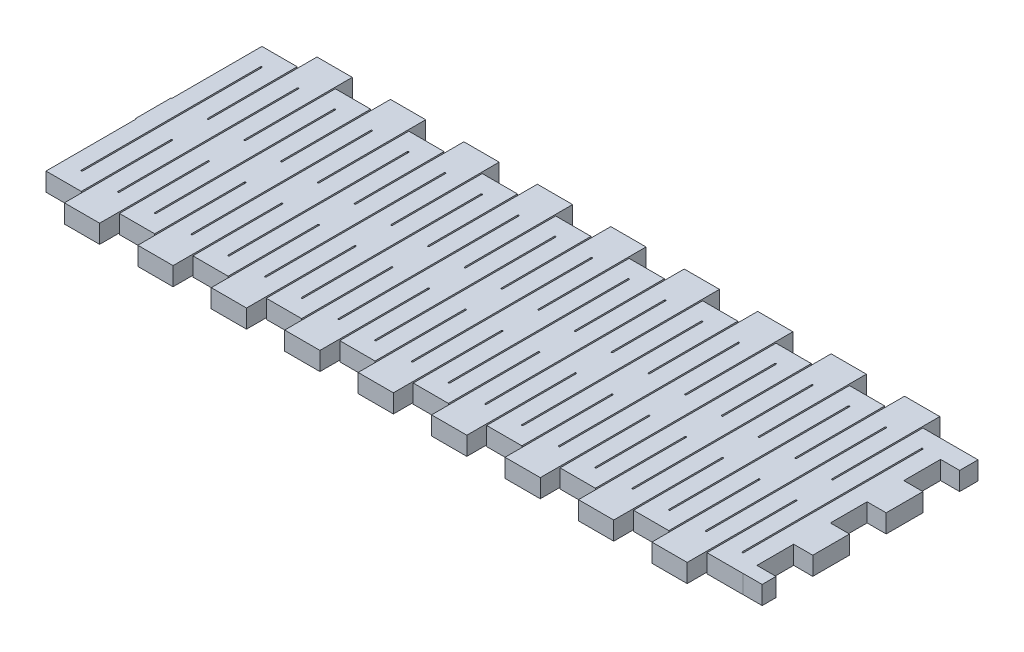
SolidWorks part; units mm, degrees
ref_plane "Front Plane" through (0, 0, 0) normal (0, 0, 1) x (1, 0, 0)
ref_plane "Top Plane" through (0, 0, 0) normal (0, 1, 0) x (1, 0, 0)
ref_plane "Right Plane" through (0, 0, 0) normal (1, 0, 0) x (0, 0, -1)
sketch "Sketch1" plane through (0, 0, 0) normal (0, 1, 0) x (1, 0, 0)
  line L1 (0, 0) -> (123.952, 0)
  line L2 (0, 0) -> (0, 43.688)
  line L3 (0, 43.688) -> (123.952, 43.688)
  line L4 (123.952, 0) -> (123.952, 43.688)
  dimension "D1" = 43.688
  dimension "D2" = 123.952
extrude "body" add sketch "Sketch1" along normal blind 3.175
sketch "Sketch2" plane through (0, 3.175, 0) normal (0, 1, 0) x (1, 0, 0)
  line L0 (0, 43.688) -> (0, 25.019) construction
  line L2 (0.127, 43.688) -> (0.127, 25.019)
  line L3 (-0.127, 43.688) -> (-0.127, 25.019)
  line L4 (0, 21.844) -> (123.952, 21.844) construction
  line L5 (0, 43.688) -> (0, 0) construction
  line L6 (123.952, 0) -> (123.952, 43.688) construction
  line L7 (0, 0) -> (0, 18.669) construction
  line L8 (0.127, 0) -> (0.127, 18.669)
  line L9 (-0.127, 0) -> (-0.127, 18.669)
  line L10 (3.175, 37.338) -> (3.175, 6.35) construction
  line L11 (3.302, 37.338) -> (3.302, 6.35)
  line L12 (3.048, 37.338) -> (3.048, 6.35)
  arc A0 (0.127, 43.688) -> (-0.127, 43.688) centre (0, 43.688) ccw
  arc A1 (-0.127, 25.019) -> (0.127, 25.019) centre (0, 25.019) ccw
  arc A2 (0.127, 0) -> (-0.127, 0) centre (0, 0) cw
  arc A3 (-0.127, 18.669) -> (0.127, 18.669) centre (0, 18.669) cw
  arc A4 (3.302, 37.338) -> (3.048, 37.338) centre (3.175, 37.338) ccw
  arc A5 (3.048, 6.35) -> (3.302, 6.35) centre (3.175, 6.35) ccw
  point P4 (0, 34.3535)
  point P17 (0, 9.3345)
  point P24 (3.175, 21.844)
  dimension "D1" = 0.254
  dimension "D2" = 0.254
  dimension "D3" = 3.175
  dimension "D4" = 0
  dimension "D5" = 18.669
  dimension "D6" = 30.988
extrude "slots" cut sketch "Sketch2" against normal up to surface (3.175 mm away)
sketch "Sketch4" plane through (0, 3.175, 0) normal (0, 1, 0) x (1, 0, 0)
  line L0 (0, 21.844) -> (123.952, 21.844) construction
  line L1 (123.952, 43.688) -> (0.127, 43.688) construction
  line L2 (0, 24.892) -> (0, 18.796) construction
  line L3 (0, 43.688) -> (6.35, 43.688)
  line L4 (0, 43.688) -> (0, 40.513)
  line L6 (123.952, 0) -> (123.952, 43.688) construction
  line L7 (0, 40.513) -> (6.35, 40.513)
  line L8 (6.35, 43.688) -> (6.35, 40.513)
  line L9 (6.35, 0) -> (6.35, 3.175)
  line L10 (0, 3.175) -> (6.35, 3.175)
  line L11 (0, 0) -> (0, 3.175)
  line L12 (0, 0) -> (6.35, 0)
  point P13 (0, 42.1005)
  dimension "D1" = 0
  dimension "D2" = 6.35
  dimension "D3" = 3.175
extrude "teeth" cut sketch "Sketch4" against normal up to surface (3.175 mm away)
pattern_linear "teeth pattern" count 10 spacing 12.7 along (1, 0, 0) of "teeth"
pattern_linear "slots pattern" count 19 spacing 6.35 along (1, 0, 0) of "slots"
sketch "Sketch5" plane through (0, 3.175, 0) normal (0, 1, 0) x (1, 0, 0)
  line L0 (0, 43.688) -> (3.175, 43.688)
  line L1 (8.255, 43.688) -> (6.35, 43.688) construction
  line L2 (3.175, 43.688) -> (3.175, 0)
  line L3 (6.35, 0) -> (8.255, 0) construction
  line L4 (3.175, 0) -> (0, 0)
  line L8 (0, 0) -> (0, 43.688)
  line L9 (0, 37.338) -> (3.175, 37.338)
  line L10 (0, 30.988) -> (3.175, 30.988)
  line L11 (0, 24.638) -> (3.175, 24.638)
  line L12 (0, 18.288) -> (3.175, 18.288)
  line L13 (0, 11.938) -> (3.175, 11.938)
  line L14 (0, 5.588) -> (3.175, 5.588)
  point P5 (0, 0)
  dimension "D1" = 3.175
  dimension "D2" = 7
sketch "Sketch6" plane through (0, 3.175, 0) normal (0, 1, 0) x (1, 0, 0)
  line L1 (123.952, 21.844) -> (127.127, 21.844) construction
  line L3 (123.952, 0) -> (123.952, 43.688) construction
  line L4 (120.65, 43.688) -> (124.206, 43.688)
  line L5 (124.206, 43.688) -> (124.206, 0)
  line L6 (124.206, 0) -> (120.65, 0)
  line L7 (120.65, 0) -> (120.65, 43.688)
  line L8 (120.65, 37.338) -> (124.206, 37.338)
  line L9 (120.65, 30.988) -> (124.206, 30.988)
  line L10 (120.65, 24.638) -> (124.206, 24.638)
  line L11 (120.65, 18.288) -> (124.206, 18.288)
  line L12 (120.65, 11.938) -> (124.206, 11.938)
  line L13 (120.65, 5.588) -> (124.206, 5.588)
  line L14 (124.206, 40.513) -> (120.65, 40.513)
  line L15 (173.609, 40.513) -> (179.705, 40.513) construction
  line L16 (124.206, 3.1857) -> (120.65, 3.1857)
  line L17 (114.173, 43.688) -> (114.173, 25.019) construction
  dimension "D1" = 3.175
  dimension "D3" = 3.556
  dimension "D4" = 6.477
  dimension "D2" = 7
extrude "Cut-Extrude5" cut sketch "Sketch6" against normal up to surface (3.175 mm away)
